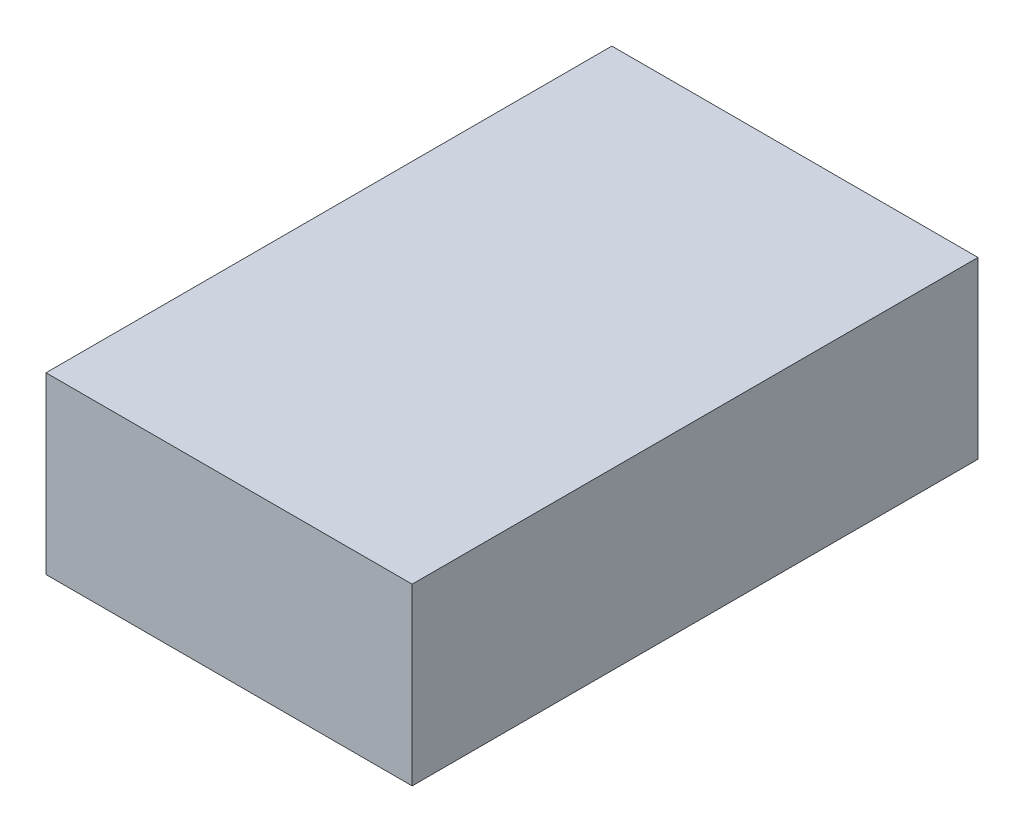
SolidWorks part; units mm, degrees
ref_plane "前视基准面" through (0, 0, 0) normal (0, 0, 1) x (1, 0, 0)
ref_plane "上视基准面" through (0, 0, 0) normal (0, 1, 0) x (1, 0, 0)
ref_plane "右视基准面" through (0, 0, 0) normal (1, 0, 0) x (0, 0, -1)
other "Configuration Table"
sketch "草图1" plane through (0, 0, 0) normal (0, 1, 0) x (1, 0, 0)
  line L1 (0, 0) -> (44, 0)
  line L2 (0, 0) -> (0, 68)
  line L3 (0, 68) -> (44, 68)
  line L4 (44, 0) -> (44, 68)
  dimension "D1" = 68
  dimension "D2" = 44
extrude "凸台-拉伸1" add sketch "草图1" along normal blind 21
